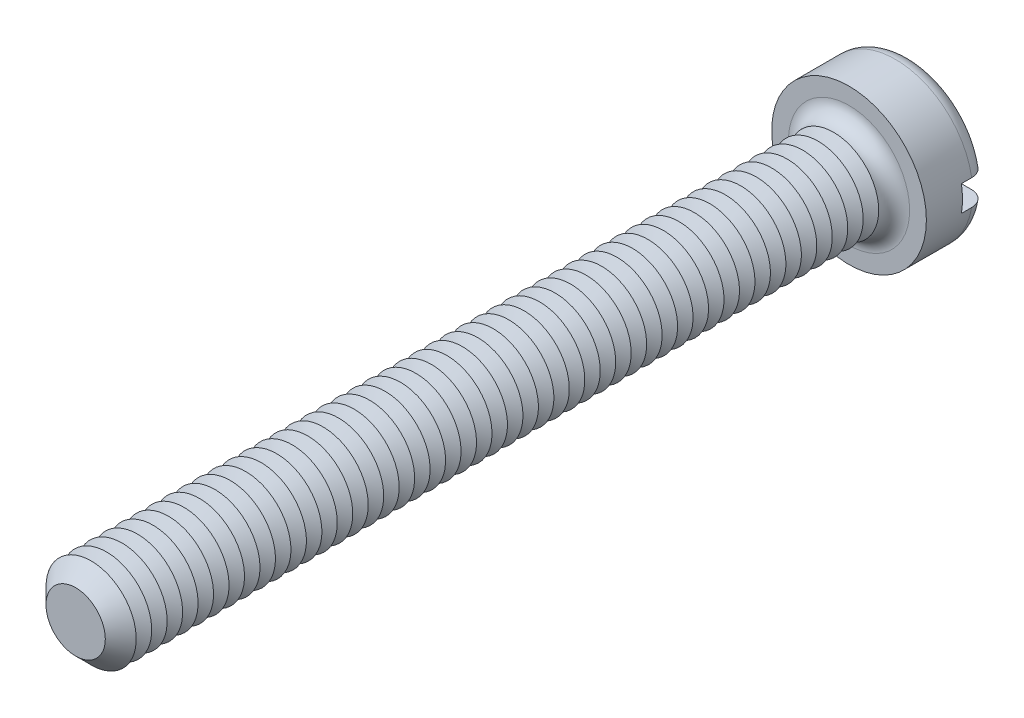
SolidWorks part; units mm, degrees
ref_plane "Front Plane" through (0, 0, 0) normal (0, 0, 1) x (1, 0, 0)
ref_plane "Top Plane" through (0, 0, 0) normal (0, 1, 0) x (1, 0, 0)
ref_plane "Right Plane" through (0, 0, 0) normal (1, 0, 0) x (0, 0, -1)
sketch "Sketch3" plane through (0, 0, 0) normal (0, 0, 1) x (1, 0, 0)
  circle A0 centre (0, 0) radius 3
  dimension "D1" = 6
extrude "Boss-Extrude2" add sketch "Sketch3" against normal blind 2.4
sketch "Sketch4" plane through (0, 0, 0) normal (0, 0, 1) x (1, 0, 0)
  circle A0 centre (0, 0) radius 1.75
  dimension "D1" = 3.5
extrude "Boss-Extrude3" add sketch "Sketch4" along normal blind 30
fillet "Fillet1" radius 0.6 2 edges at (3, 0, -2.4) (1.75, 0, 0)
chamfer "Chamfer1" distance 0.6 angle 45 1 edges at (1.75, 0, 30)
sketch "Sketch5" plane through (0, 0, 0) normal (1, 0, 0) x (0, 0, -1)
  line L0 (1.6944, 0) -> (-7.6738, 0) construction
sketch "Sketch6" plane through (0, 0, 0) normal (1, 0, 0) x (0, 0, -1)
  line L0 (-0.6, 1.75) -> (-0.9, 1.2304)
  line L1 (-0.9, 1.2304) -> (-1.2, 1.75)
  line L2 (-0.6, 1.75) -> (-29.4, 1.75) construction
  line L3 (-1.2, 1.75) -> (-0.6, 1.75)
  dimension "D1" = 0.6
revolve "Cut-Revolve1" cut sketch "Sketch6" angle 360 about L0
pattern_linear "LPattern1" count 48 spacing 0.6 along (0, 0, 1) of "Cut-Revolve1"
sketch "Sketch8" plane through (0, 0, -2.4) normal (0, 0, -1) x (-1, 0, 0)
  line L1 (3, -0.5) -> (-3, -0.5)
  line L2 (3, -0.5) -> (3, 0.5)
  line L3 (3, 0.5) -> (-3, 0.5)
  line L4 (-3, -0.5) -> (-3, 0.5)
  line L5 (3, -0.5) -> (-3, 0.5) construction
  line L6 (3, 0.5) -> (-3, -0.5) construction
  point P0 (0, 0)
  dimension "D1" = 6
  dimension "D2" = 1
extrude "Cut-Extrude1" cut sketch "Sketch8" against normal blind 1
